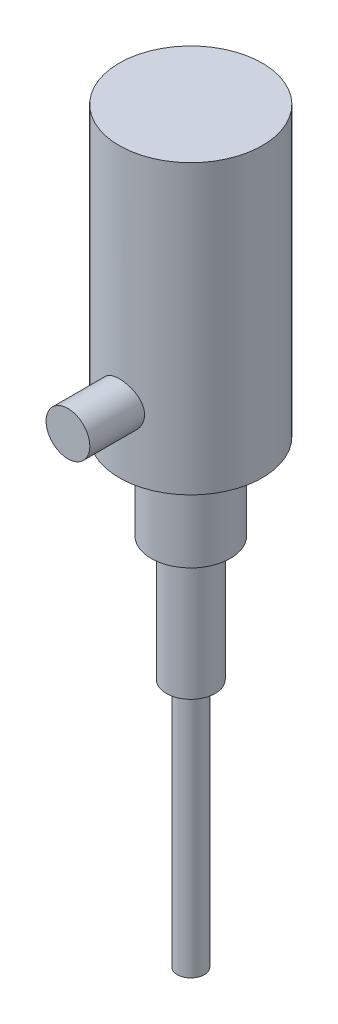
SolidWorks part; units mm, degrees
ref_plane "Front Plane" through (0, 0, 0) normal (0, 0, 1) x (1, 0, 0)
ref_plane "Top Plane" through (0, 0, 0) normal (0, 1, 0) x (1, 0, 0)
ref_plane "Right Plane" through (0, 0, 0) normal (1, 0, 0) x (0, 0, -1)
sketch "Sketch1" plane through (0, 0, 0) normal (0, 0, 1) x (1, 0, 0)
  line L0 (0, 0) -> (-8, 0)
  line L1 (-8, 0) -> (-8, 148)
  line L2 (-8, 148) -> (-14.5, 148)
  line L3 (-14.5, 148) -> (-14.5, 222)
  line L4 (-14.5, 222) -> (-23.5, 222)
  line L5 (-23.5, 222) -> (-23.5, 273)
  line L6 (-23.5, 273) -> (-42.5, 273)
  line L7 (0, 444) -> (0, 0)
  line L8 (-42.5, 273) -> (-42.5, 444)
  line L9 (-42.5, 444) -> (0, 444)
  dimension "D1" = 8
  dimension "D2" = 148
  dimension "D3" = 14.5
  dimension "D4" = 23.5
  dimension "D5" = 74
  dimension "D6" = 51
  dimension "D7" = 42.5
  dimension "D8" = 444
revolve "Revolve1" add sketch "Sketch1" angle 360 about L7
ref_plane "Plane1" through (0, 0, 73) normal (0, 0, 1) x (1, 0, 0)
sketch "Sketch2" plane through (0, 0, 73) normal (0, 0, 1) x (1, 0, 0)
  line L0 (42.5, 444) -> (-42.5, 444) construction
  line L1 (0, 311) -> (0, 444) construction
  circle A0 centre (0, 311) radius 13
  dimension "D1" = 133
  dimension "D2" = 26
extrude "Boss-Extrude1" add sketch "Sketch2" against normal up to surface (32.5371 mm away)
